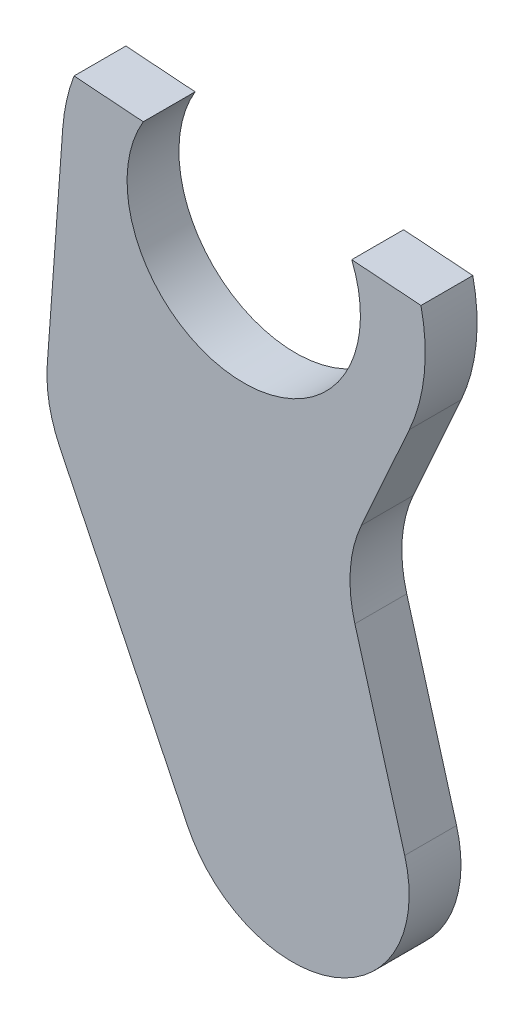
SolidWorks part; units mm, degrees
ref_plane "正面" through (0, 0, 0) normal (0, 0, 1) x (1, 0, 0)
ref_plane "平面" through (0, 0, 0) normal (0, 1, 0) x (1, 0, 0)
ref_plane "右側面" through (0, 0, 0) normal (1, 0, 0) x (0, 0, -1)
sketch "ｽｹｯﾁ1" plane through (0, 0, 0) normal (0, 0, 1) x (1, 0, 0)
  line L12 (6.8359, 1.5069) -> (4.1659, 1.7016)
  line L13 (-3.875, 2.2878) -> (-6.545, 2.4825)
  line L14 (-6.9815, 0.509) -> (-7.5771, -7.6597)
  line L15 (-7.0908, -10.2018) -> (-2.1713, -20.3647)
  line L16 (6.2084, -17.1765) -> (4.2872, -10.4004)
  line L17 (4.5359, -6.9893) -> (6.3863, -2.8661)
  arc A14 (0, -4.5) -> (4.1659, 1.7016) centre (0, 0) ccw
  arc A15 (-3.875, 2.2878) -> (0, -4.5) centre (0, 0) ccw
  arc A16 (-6.545, 2.4825) -> (-6.9815, 0.509) centre (0, 0) ccw
  arc A17 (-7.5771, -7.6597) -> (-7.0908, -10.2018) centre (-2.5903, -8.0233) ccw
  arc A18 (-2.1713, -20.3647) -> (6.2084, -17.1765) centre (1.8791, -18.404) ccw
  arc A19 (4.5359, -6.9893) -> (4.2872, -10.4004) centre (9.0976, -9.0365) ccw
  arc A20 (6.3863, -2.8661) -> (6.8359, 1.5069) centre (0, 0) ccw
extrude "ﾎﾞｽ - 押し出し1" add sketch "ｽｹｯﾁ1" along normal blind 2 contours A14 L12 A20 L17 A19 L16 A18 L15 A17 L14 A16 L13 A15
